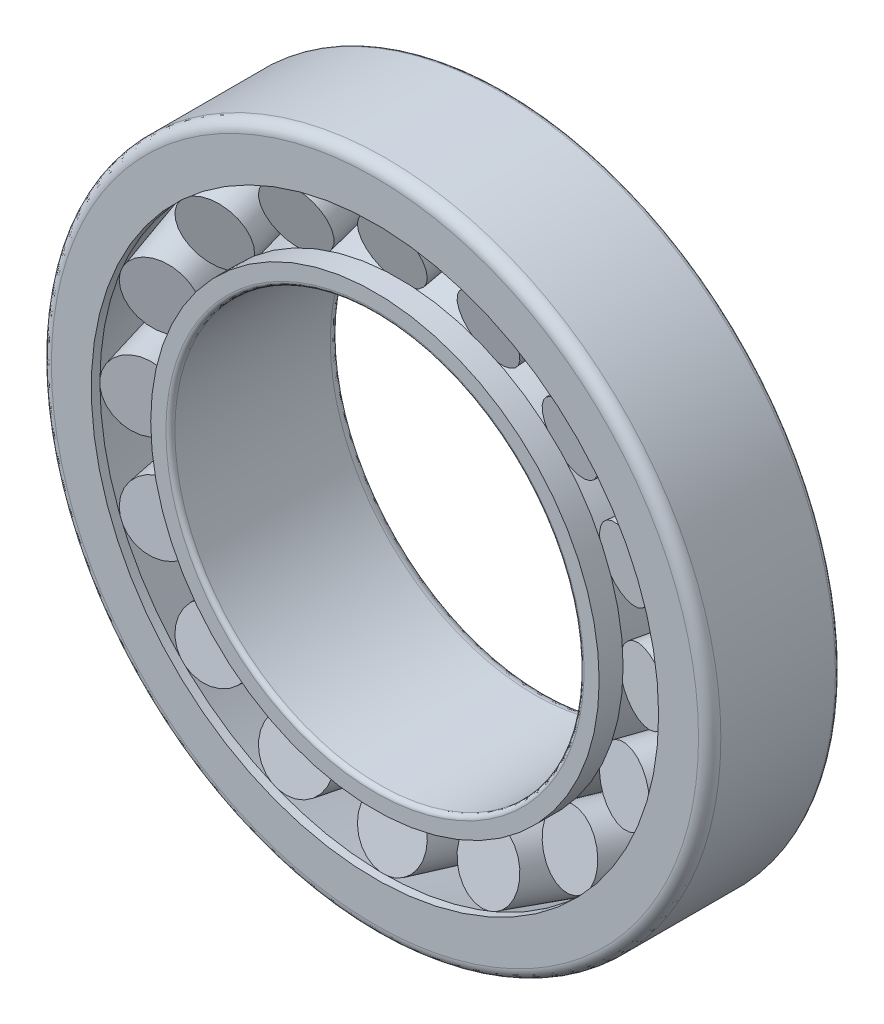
SolidWorks part; units mm, degrees
ref_plane "Front Plane" through (0, 0, 0) normal (0, 0, 1) x (1, 0, 0)
ref_plane "Top Plane" through (0, 0, 0) normal (0, 1, 0) x (1, 0, 0)
ref_plane "Right Plane" through (0, 0, 0) normal (1, 0, 0) x (0, 0, -1)
sketch "BaseSke" plane through (0, 0, 0) normal (1, 0, 0) x (0, 0, -1)
  line L0 (-47.2296, 0) -> (24.6132, 0) construction
  line L2 (0, 129.5214) -> (0, -86.3012) construction
  line L3 (8.6572, 41.7141) -> (-31.6572, 30.7859) construction
  line L4 (-23, 45) -> (-5.5, 45) construction
  line L5 (-23, 27.5) -> (0, 27.5) construction
  line L6 (-11.5, 36.25) -> (-18.5822, 62.3763) construction
  line L7 (-21.85, 38.1543) -> (-6.65, 42.705)
  line L8 (-6.65, 42.705) -> (-5.352, 37.9166)
  line L9 (-5.352, 37.9166) -> (-20.6606, 33.7668)
  line L10 (-20.6606, 33.7668) -> (-21.85, 38.1543)
  line L11 (-23, 45) -> (-23, 38.135) construction
  line L12 (-21.8448, 38.135) -> (-5.5, 43.0284) construction
  line L13 (-5.5, 45) -> (-5.5, 43.0284) construction
  line L14 (-21.8448, 38.135) -> (-23, 38.135) construction
  line L15 (-19.4713, 29.3792) -> (-4.054, 33.1282) construction
  line L16 (-23, 27.5) -> (-23, 30.1459) construction
  line L17 (-23, 30.1459) -> (-19.7827, 30.1459) construction
  line L18 (0, 33.8948) -> (0, 27.5) construction
  line L19 (-19.7827, 30.1459) -> (-19.5816, 29.4039) construction
  line L20 (-19.5816, 29.4039) -> (-3.9698, 33.2001) construction
  line L21 (-3.9698, 33.2001) -> (-4.1582, 33.8948) construction
  line L22 (-4.1582, 33.8948) -> (0, 33.8948) construction
  dimension "D2" = 11.5
  dimension "D1" = 0.02
  dimension "Outer_Thickness" = 17.5
  dimension "Bearing_Outside_Diameter" = 90
  dimension "Bearing_Inside_Diameter" = 55
  dimension "Inner_Thickness" = 23
  dimension "Bearing_Thickness" = 23
  dimension "Angle" = 15.167
  dimension "D3" = 72.5
  dimension "D4" = 1.15
  dimension "D5" = 1.15
  dimension "D6" = 1.5
  dimension "D7" = 0.1
  dimension "Roller_diameter" = 76.27
  dimension "D8" = 0.7667
  dimension "D9" = 0.05
  dimension "D10" = 0.1
  dimension "D11" = 0.7667
revolve "Roller" add sketch "BaseSke" angle 360 about L3
sketch "OuterRaceSke" plane through (0, 0, 0) normal (1, 0, 0) x (0, 0, -1)
  line L0 (-21.8448, 38.135) -> (-23, 38.135) construction
  line L1 (-21.8448, 38.135) -> (-5.5, 43.0284) construction
  line L2 (-5.5, 45) -> (-5.5, 43.0284) construction
  line L3 (-23, 45) -> (-5.5, 45) construction
  line L4 (-23, 45) -> (-23, 38.135) construction
  line L5 (-21.8448, 38.135) -> (-23, 38.135)
  line L6 (-21.8448, 38.135) -> (-5.5, 43.0284)
  line L7 (-5.5, 45) -> (-5.5, 43.0284)
  line L8 (-23, 45) -> (-5.5, 45)
  line L9 (-23, 45) -> (-23, 38.135)
  line L10 (-60.3939, 0) -> (35.9926, 0) construction
revolve "OuterRace" add sketch "OuterRaceSke" angle 360 about L10
sketch "InnerRaceSke" plane through (0, 0, 0) normal (1, 0, 0) x (0, 0, -1)
  line L0 (-23, 27.5) -> (0, 27.5) construction
  line L1 (-23, 27.5) -> (-23, 30.1459) construction
  line L2 (-23, 30.1459) -> (-19.7827, 30.1459) construction
  line L3 (-19.7827, 30.1459) -> (-19.5816, 29.4039) construction
  line L4 (-19.5816, 29.4039) -> (-3.9698, 33.2001) construction
  line L5 (-3.9698, 33.2001) -> (-4.1582, 33.8948) construction
  line L6 (-4.1582, 33.8948) -> (0, 33.8948) construction
  line L7 (0, 33.8948) -> (0, 27.5) construction
  line L8 (-23, 27.5) -> (0, 27.5)
  line L9 (-23, 27.5) -> (-23, 30.1459)
  line L10 (-23, 30.1459) -> (-19.7827, 30.1459)
  line L11 (-19.7827, 30.1459) -> (-19.5816, 29.4039)
  line L12 (-19.5816, 29.4039) -> (-3.9698, 33.2001)
  line L13 (-3.9698, 33.2001) -> (-4.1582, 33.8948)
  line L14 (-4.1582, 33.8948) -> (0, 33.8948)
  line L15 (0, 33.8948) -> (0, 27.5)
  line L16 (-58.1022, 0) -> (39.538, 0) construction
revolve "InnerRace" add sketch "InnerRaceSke" angle 360 about L16
fillet "Fillet1" radius 0.6 2 edges at (45, 0, 5.5) (27.5, 0, 23)
fillet "InnerFillet" radius 1.5 1 edges at (27.5, 0, 0)
fillet "OuterFillet" radius 1.5 1 edges at (45, 0, 23)
pattern_circular "CirPatternBall" count 16 over 360 about axis through (0, 0, 0) along (0, 0, 1) of "Roller"
sketch "Sketch4" plane through (0, 0, 0) normal (1, 0, 0) x (0, 0, -1)
  line L0 (-21.85, 38.1543) -> (-6.65, 42.705)
  line L1 (-6.65, 42.705) -> (-4.054, 33.1282)
  line L2 (-4.054, 33.1282) -> (-19.4713, 29.3792)
  line L3 (-19.4713, 29.3792) -> (-21.85, 38.1543)
  line L4 (-40.3293, 0) -> (19.5574, 0) construction
revolve "Simplified" [suppressed] add sketch "Sketch4" angle 360 about L4
equation "\"D2@BaseSke\" = \"Bearing_Thickness@BaseSke\"/2"
equation "\"D3@BaseSke\" =  ( \"Bearing_Outside_Diameter@BaseSke\" + \"Bearing_Inside_Diameter@BaseSke\" )  / 2"
equation "\"Roller_diameter@BaseSke\" = \"D3@BaseSke\"*1.052"
equation "\"D4@BaseSke\" = \"Bearing_Thickness@BaseSke\"/20"
equation "\"D5@BaseSke\" = \"Bearing_Thickness@BaseSke\" / 20"
equation "\"D8@BaseSke\" = \"Bearing_Thickness@BaseSke\"/30"
equation "\"D11@BaseSke\" = \"D8@BaseSke\""
equation "\"D1@CirPatternBall\" = int(  \"D3@BaseSke\" *  pi  /  ( \"Bearing_Outside_Diameter@BaseSke\" - \"Bearing_Inside_Diameter@BaseSke\" )  * 2.5 ) "
